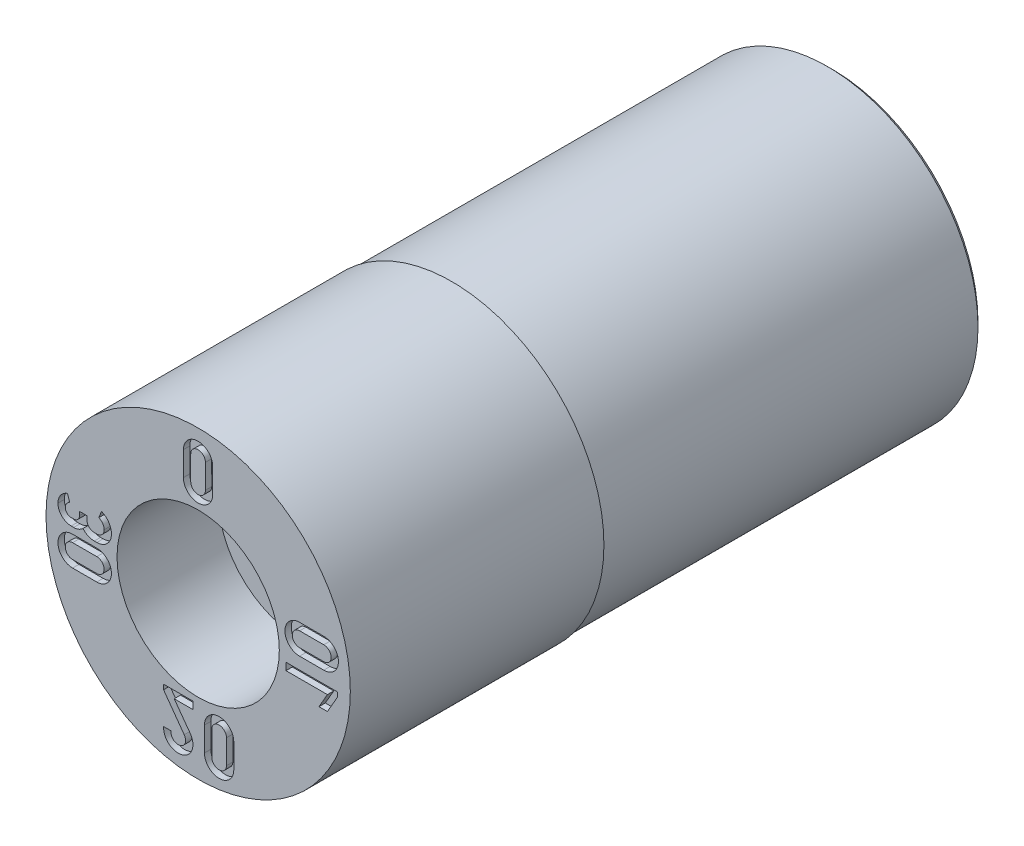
SolidWorks part; units mm, degrees
ref_plane "Front Plane" through (0, 0, 0) normal (0, 0, 1) x (1, 0, 0)
ref_plane "Top Plane" through (0, 0, 0) normal (0, 1, 0) x (1, 0, 0)
ref_plane "Right Plane" through (0, 0, 0) normal (1, 0, 0) x (0, 0, -1)
sketch "Sketch1" plane through (0, 0, 0) normal (1, 0, 0) x (0, 0, -1)
  line L2 (0, 6) -> (0, 3.2)
  line L3 (24.75, 6) -> (0, 6)
  line L4 (-3.7979, 0) -> (49996.2021, 0) construction
  line L8 (19, 1.5) -> (4, 1.5)
  line L9 (4, 3.2) -> (4, 1.5)
  line L10 (4, 3.2) -> (0, 3.2)
  line L12 (25, 3) -> (25, 5.75)
  line L16 (25, 5.75) -> (24.75, 6)
  line L17 (25, 3) -> (19, 3)
  line L18 (19, 1.5) -> (19, 3)
  dimension "D1" = 25
  dimension "D2" = 45
  dimension "D3" = 0.25
  dimension "D4" = 12
  dimension "D5" = 6.4
  dimension "D6" = 4
  dimension "D7" = 3
  dimension "D8" = 6
  dimension "D9" = 6
revolve "Revolve1" add sketch "Sketch1" angle 360 about L4
sketch "Sketch4" plane through (0, 0, 0) normal (1, 0, 0) x (0, 0, -1)
  line L0 (0, 0) -> (50000, 0) construction
  line L1 (25, -5.75) -> (25, 5.75) construction
  line L2 (10, 6.935) -> (25, 6.935)
  line L3 (10, 6.935) -> (10, 5.935)
  line L4 (10, 5.935) -> (25, 5.935)
  line L5 (25, 6.935) -> (25, 5.935)
  line L6 (24.75, 6) -> (0, 6) construction
  line L9 (0, 6.6) -> (0, -6.6) construction
  dimension "D1" = 1
  dimension "D2" = 0.065
  dimension "D3" = 10
revolve "Cut-Revolve1" cut sketch "Sketch4" angle 360 about L0
sketch "Sketch2" plane through (0, 0, 0) normal (0, 0, 1) x (1, 0, 0)
  line L885 (0.5373, -4.0225) -> (0.5374, -4.9765)
  line L886 (1.1155, -4.9765) -> (1.1155, -4.0224)
  line L887 (1.4047, -4.9764) -> (1.4048, -4.0224)
  line L888 (0.2481, -4.0225) -> (0.2481, -4.9765)
  line L889 (-3.9965, 0.3772) -> (-4.0977, 0.3772)
  line L890 (-4.3867, 0.6662) -> (-4.3867, 0.8108)
  line L891 (-4.3867, 0.8108) -> (-4.6758, 0.8108)
  line L892 (-4.6758, 0.8108) -> (-4.6758, 0.6663)
  line L893 (-4.9071, 0.4351) -> (-5.0083, 0.4351)
  line L894 (-5.0626, 0.9128) -> (-5.1551, 1.1867)
  line L895 (-5.0083, 0.1459) -> (-4.9071, 0.1459)
  line L896 (-4.0977, 0.0881) -> (-3.9965, 0.0881)
  line L897 (-3.8117, 1.2444) -> (-3.9178, 0.9756)
  line L898 (4.9536, 1.3606) -> (3.9996, 1.3605)
  line L899 (3.9997, 0.204) -> (4.9537, 0.2041)
  line L900 (3.9997, 0.4931) -> (4.9537, 0.4932)
  line L901 (4.9536, 1.0715) -> (3.9996, 1.0714)
  line L902 (5.4865, -0.2697) -> (5.4865, -0.46)
  line L903 (5.4865, -0.46) -> (5.0973, -1.137)
  line L904 (5.0973, -1.137) -> (4.7639, -1.137)
  line L905 (4.7639, -1.137) -> (5.0962, -0.5588)
  line L906 (5.0962, -0.5588) -> (3.4629, -0.559)
  line L907 (3.4629, -0.559) -> (3.4629, -0.2699)
  line L908 (3.4629, -0.2699) -> (5.4865, -0.2697)
  line L909 (-0.2069, -3.722) -> (-0.207, -3.4329)
  line L910 (-0.207, -3.4329) -> (-1.3633, -3.433)
  line L911 (-1.3633, -3.433) -> (-1.3633, -3.6242)
  line L912 (-1.3633, -3.6242) -> (-0.5503, -4.7527)
  line L913 (-1.0708, -4.8784) -> (-1.3616, -4.8784)
  line L914 (-0.3153, -4.5835) -> (-0.9442, -3.7221)
  line L915 (-0.9442, -3.7221) -> (-0.2069, -3.722)
  line L916 (-0.5816, 4.9666) -> (-0.5815, 4.0127)
  line L917 (0.5748, 4.0127) -> (0.5749, 4.9667)
  line L918 (0.2858, 4.0127) -> (0.2857, 4.9667)
  line L919 (-0.2924, 4.9667) -> (-0.2925, 4.0126)
  line L920 (-3.9973, -0.9725) -> (-4.9513, -0.9722)
  line L921 (-4.9512, -0.3941) -> (-3.9972, -0.3941)
  line L922 (-4.9512, -0.1049) -> (-3.9972, -0.105)
  line L923 (-3.9973, -1.2615) -> (-4.9513, -1.2615)
  arc A430 (1.1155, -4.0224) -> (0.5373, -4.0225) centre (0.8264, -4.0225) ccw
  arc A431 (0.5374, -4.9765) -> (1.1155, -4.9765) centre (0.8264, -4.9765) ccw
  arc A432 (1.4048, -4.0224) -> (0.2481, -4.0225) centre (0.8264, -4.0225) ccw
  arc A433 (0.2481, -4.9765) -> (1.4047, -4.9764) centre (0.8264, -4.9765) ccw
  arc A434 (-3.7074, 0.6663) -> (-3.9178, 0.9756) centre (-4.0399, 0.6663) ccw
  arc A435 (-3.9965, 0.3772) -> (-3.7074, 0.6663) centre (-3.9965, 0.6663) ccw
  arc A436 (-4.3867, 0.6662) -> (-4.0977, 0.3772) centre (-4.0977, 0.6662) ccw
  arc A437 (-4.9071, 0.4351) -> (-4.6758, 0.6663) centre (-4.9071, 0.6663) ccw
  arc A438 (-5.2395, 0.6664) -> (-5.0083, 0.4351) centre (-5.008, 0.6666) ccw
  arc A439 (-5.0626, 0.9128) -> (-5.2395, 0.6664) centre (-4.9797, 0.6666) ccw
  arc A440 (-5.1551, 1.1867) -> (-5.5286, 0.6664) centre (-4.9792, 0.6663) ccw
  arc A441 (-5.5286, 0.6664) -> (-5.0083, 0.1459) centre (-5.0083, 0.6663) ccw
  arc A442 (-4.9071, 0.1459) -> (-4.5417, 0.2959) centre (-4.9071, 0.6661) ccw
  arc A443 (-4.5417, 0.2959) -> (-4.0977, 0.0881) centre (-4.0978, 0.666) ccw
  arc A444 (-3.9965, 0.0881) -> (-3.4183, 0.6662) centre (-3.9964, 0.6662) ccw
  arc A445 (-3.4183, 0.6662) -> (-3.8117, 1.2444) centre (-4.0401, 0.6662) ccw
  arc A446 (3.9996, 1.3605) -> (3.9997, 0.204) centre (3.9997, 0.7823) ccw
  arc A447 (4.9537, 0.2041) -> (4.9536, 1.3606) centre (4.9537, 0.7823) ccw
  arc A448 (3.9996, 1.0714) -> (3.9997, 0.4931) centre (3.9997, 0.7823) ccw
  arc A449 (4.9537, 0.4932) -> (4.9536, 1.0715) centre (4.9537, 0.7823) ccw
  arc A450 (-1.0708, -4.8784) -> (-0.5503, -4.7527) centre (-0.7849, -4.9218) ccw
  arc A451 (-1.3616, -4.8784) -> (-0.3153, -4.5835) centre (-0.7848, -4.9214) ccw
  arc A452 (-0.5815, 4.0127) -> (0.5748, 4.0127) centre (-0.0034, 4.0127) ccw
  arc A453 (0.5749, 4.9667) -> (-0.5816, 4.9666) centre (-0.0034, 4.9667) ccw
  arc A454 (-0.2925, 4.0126) -> (0.2858, 4.0127) centre (-0.0034, 4.0127) ccw
  arc A455 (0.2857, 4.9667) -> (-0.2924, 4.9667) centre (-0.0034, 4.9667) ccw
  arc A456 (-3.9973, -0.9725) -> (-3.9972, -0.3941) centre (-3.9972, -0.6833) ccw
  arc A457 (-4.9512, -0.3941) -> (-4.9513, -0.9722) centre (-4.9512, -0.6832) ccw
  arc A458 (-3.9973, -1.2615) -> (-3.9972, -0.105) centre (-3.9972, -0.6833) ccw
  arc A459 (-4.9512, -0.1049) -> (-4.9513, -1.2615) centre (-4.9512, -0.6832) ccw
  point P1737 (0, 0.0093)
  point P1738 (0.0093, 0.0093)
  point P1739 (0.0093, 0)
extrude "Cut-Extrude1" cut sketch "Sketch2" against normal blind 0.25
sketch "Sketch3" plane through (0, 0, -4) normal (0, 0, 1) x (1, 0, 0)
  line L0 (0, 0) -> (0, 50000) construction
  line L1 (0.866, 1.5) -> (-0.866, 1.5)
  line L2 (-0.866, 1.5) -> (-1.7321, 0)
  line L3 (-1.7321, 0) -> (-0.866, -1.5)
  line L4 (-0.866, -1.5) -> (0.866, -1.5)
  line L5 (0.866, -1.5) -> (1.7321, 0)
  line L6 (1.7321, 0) -> (0.866, 1.5)
  line L7 (0, 0) -> (50000, 0) construction
  circle A0 centre (0, 0) radius 1.5 construction
  circle A1 centre (0, 0) radius 1.5 construction
extrude "Cut-Extrude2" cut sketch "Sketch3" against normal blind 3
